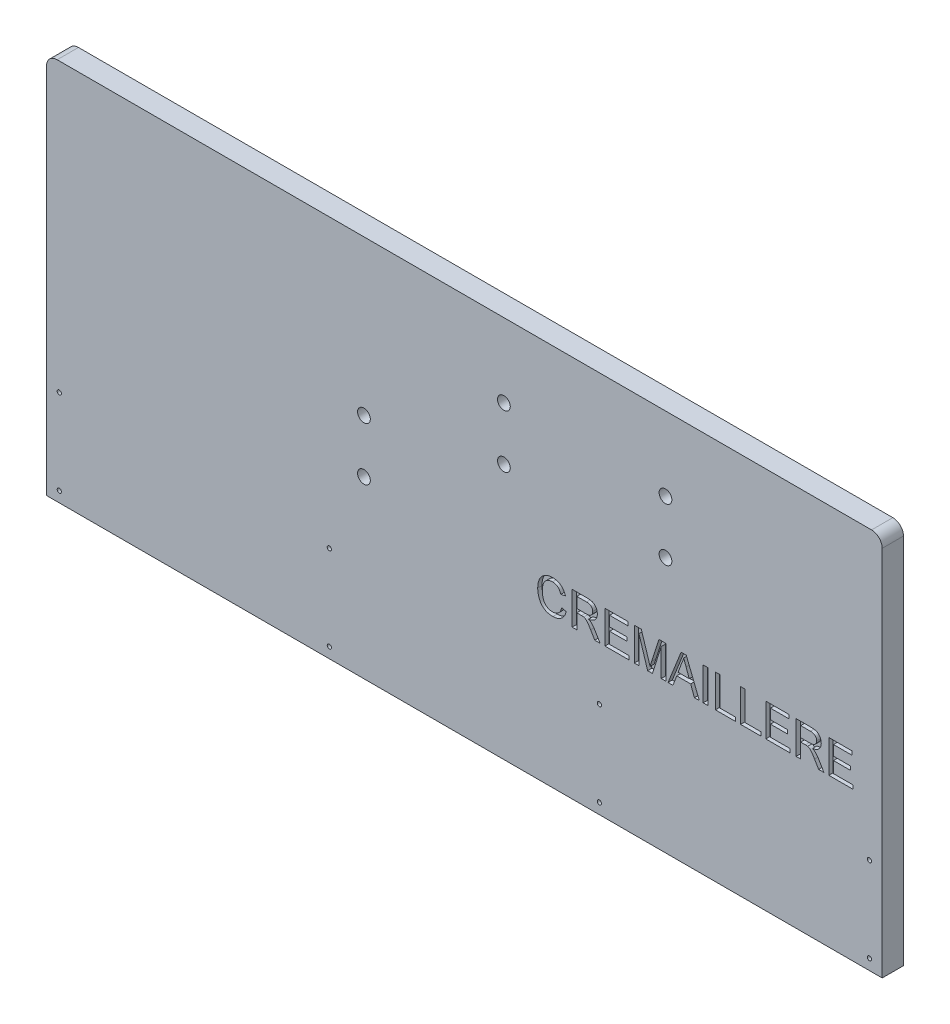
SolidWorks part; units mm, degrees
ref_plane "Plan de face" through (0, 0, 0) normal (0, 0, 1) x (1, 0, 0)
ref_plane "Plan de dessus" through (0, 0, 0) normal (0, 1, 0) x (1, 0, 0)
ref_plane "Plan de droite" through (0, 0, 0) normal (1, 0, 0) x (0, 0, -1)
sketch "Esquisse1" plane through (0, 0, 0) normal (0, 0, 1) x (1, 0, 0)
  line L0 (31.1578, 30) -> (400, 30) construction
  line L1 (0, 0) -> (393, 0)
  line L2 (0, 0) -> (0, 175)
  line L3 (5, 180) -> (388, 180)
  line L4 (393, 0) -> (393, 175)
  line L5 (110, -15.5181) -> (110, 46.0083) construction
  line L6 (53.1335, 61.25) -> (400, 61.25) construction
  line L7 (149.27, -12.2348) -> (149.27, 164.5159) construction
  line L8 (116.2588, 107.25) -> (188.4482, 107.25) construction
  line L9 (149.27, 107.25) -> (215.0879, 145.25) construction
  line L10 (133.2086, 82.25) -> (163.4702, 82.25) construction
  line L11 (205.6224, 145.25) -> (294.8275, 145.25) construction
  line L12 (215.0879, 154.6337) -> (215.0879, 94.3) construction
  line L13 (291.0879, 157.5949) -> (291.0879, 94.3) construction
  line L14 (209.3239, 120.25) -> (294.8275, 120.25) construction
  line L15 (-19.9116, 180) -> (410.2975, 180) construction
  line L16 (393, -32.3821) -> (393, 243.352) construction
  circle A0 centre (149.27, 107.25) radius 3
  circle A1 centre (149.27, 82.25) radius 3
  circle A2 centre (215.0879, 145.25) radius 3
  circle A3 centre (215.0879, 120.25) radius 3
  circle A4 centre (291.0879, 145.25) radius 3
  circle A5 centre (291.0879, 120.25) radius 3
  arc A6 (0, 175) -> (5, 180) centre (5, 175) cw
  arc A7 (388, 180) -> (393, 175) centre (388, 175) cw
  dimension "D1" = 5
  dimension "D2" = 30
  dimension "D4" = 25
  dimension "D3" = 76
  dimension "D5" = 76
  dimension "D6" = 25
extrude "Extrusion1" add sketch "Esquisse1" along normal blind 10
sketch "Esquisse2" plane through (0, 0, 10) normal (0, 0, 1) x (1, 0, 0)
  line L0 (0, -13.1525) -> (0, 50) construction
  line L1 (0, 50) -> (399.1389, 50) construction
  line L2 (110, 25) -> (393, 25) construction
  line L3 (393, 0) -> (393, 175) construction
  line L5 (6, -4.3758) -> (6, 11.7533) construction
  line L6 (6, 5) -> (251.5, 5) construction
  circle A0 centre (6, 5) radius 1
  circle A1 centre (133, 5) radius 1
  circle A2 centre (260, 5) radius 1
  circle A3 centre (387, 5) radius 1
  circle A4 centre (6, 45) radius 1
  circle A5 centre (133, 45) radius 1
  circle A6 centre (260, 45) radius 1
  circle A7 centre (387, 45) radius 1
extrude "Enlèv. mat.-Extru.1" cut sketch "Esquisse2" against normal blind 2
sketch "Esquisse3" plane through (0, 0, 10) normal (0, 0, 1) x (1, 0, 0)
  line L0 (230, 219.6013) -> (230, 70) construction
  line L1 (160, 217.3884) -> (160, 178.2932) construction
  line L2 (-8.7501, 195) -> (242.0497, 195) construction
  line L3 (-8.7501, 70) -> (408.3676, 70) construction
  text T0 "CREMAILLERE" font "Arial" height in points 60
extrude "Enlèv. mat.-Extru.2" cut sketch "Esquisse3" against normal blind 2
